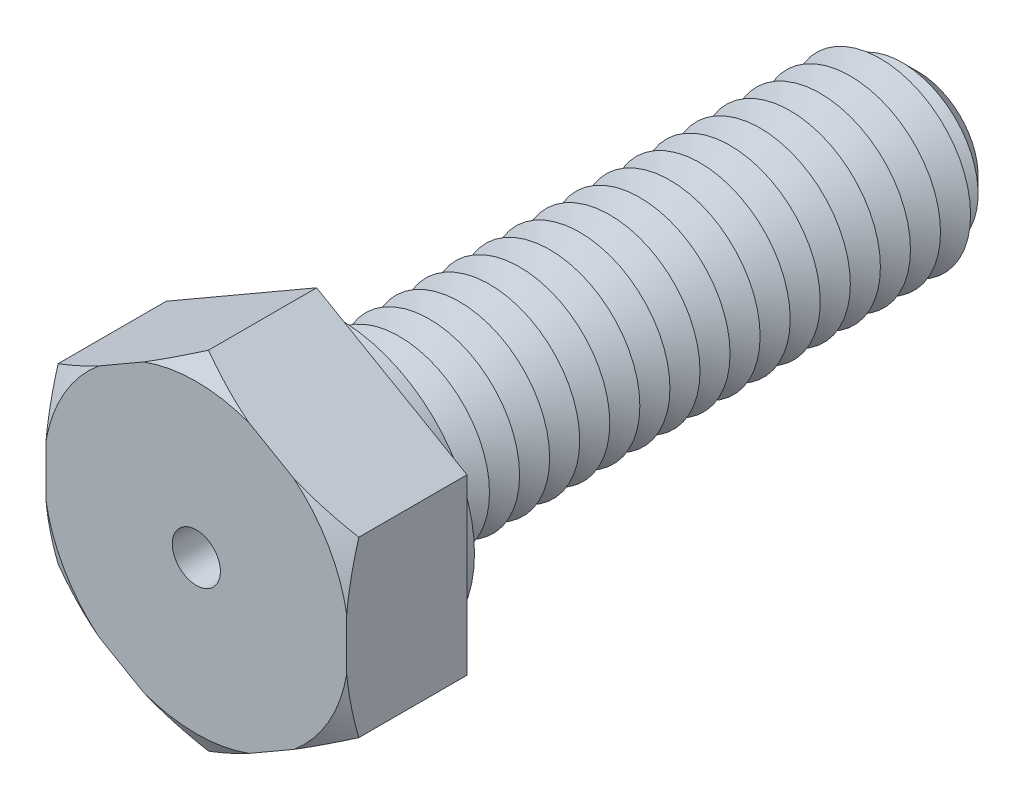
SolidWorks part; units mm, degrees
ref_plane "Front Plane" through (0, 0, 0) normal (0, 0, 1) x (1, 0, 0)
ref_plane "Top Plane" through (0, 0, 0) normal (0, 1, 0) x (1, 0, 0)
ref_plane "Right Plane" through (0, 0, 0) normal (1, 0, 0) x (0, 0, -1)
sketch "Sketch2" plane through (0, 0, 0) normal (0, 0, 1) x (1, 0, 0)
  line L1 (0, 5.7735) -> (-5, 2.8868)
  line L2 (-5, 2.8868) -> (-5, -2.8868)
  line L3 (-5, -2.8868) -> (0, -5.7735)
  line L4 (0, -5.7735) -> (5, -2.8868)
  line L5 (5, -2.8868) -> (5, 2.8868)
  line L6 (5, 2.8868) -> (0, 5.7735)
  circle A0 centre (0, 0) radius 5 construction
  dimension "D1" = 10
extrude "Boss-Extrude1" add sketch "Sketch2" along normal blind 4
sketch "Sketch3" plane through (0, 0, 0) normal (0, 0, -1) x (-1, 0, 0)
  circle A0 centre (0, 0) radius 3
  dimension "D1" = 6
extrude "Boss-Extrude2" add sketch "Sketch3" along normal blind 20
sketch "Sketch4" plane through (0, 0, 0) normal (0, 0, -1) x (-1, 0, 0)
  circle A0 centre (0, 0) radius 4.5
  dimension "D1" = 9
extrude "Boss-Extrude3" add sketch "Sketch4" along normal blind 0.75
sketch "Sketch5" plane through (0, 0, 0) normal (1, 0, 0) x (0, 0, -1)
  line L0 (-3.2117, 0) -> (6.3192, 0) construction
chamfer "Chamfer1" distance 1 angle 45 1 edges at (-3, 0, -20)
sketch "Sketch6" plane through (0, 0, 0) normal (1, 0, 0) x (0, 0, -1)
  line L0 (0.75, 3) -> (1.25, 2.134)
  line L1 (1.25, 2.134) -> (1.75, 3)
  line L2 (19, 3) -> (0.75, 3) construction
  line L3 (1.75, 3) -> (0.75, 3)
  dimension "D1" = 1
revolve "Cut-Revolve1" cut sketch "Sketch6" angle 360 about L0
pattern_linear "LPattern1" count 19 spacing 1 along (0, 0, -1) of "Cut-Revolve1"
sketch "Sketch7" plane through (0, 0, 0) normal (1, 0, 0) x (0, 0, -1)
  line L0 (-4, 5.7735) -> (-4, 5.0735)
  line L1 (-4, 2.8868) -> (-4, 5.7735) construction
  line L2 (-4, 5.0735) -> (-3.5959, 5.7735)
  line L3 (-4, 5.7735) -> (0, 5.7735) construction
  line L4 (-3.5959, 5.7735) -> (-4, 5.7735)
  dimension "D1" = 0.7
  dimension "D2" = 30
revolve "Cut-Revolve2" cut sketch "Sketch7" angle 360 about L0
sketch "Sketch8" plane through (0, 0, 4) normal (0, 0, 1) x (1, 0, 0)
  circle A0 centre (0, 0) radius 0.8
  dimension "D1" = 1.6
extrude "Cut-Extrude1" cut sketch "Sketch8" against normal up to surface (24 mm away)
